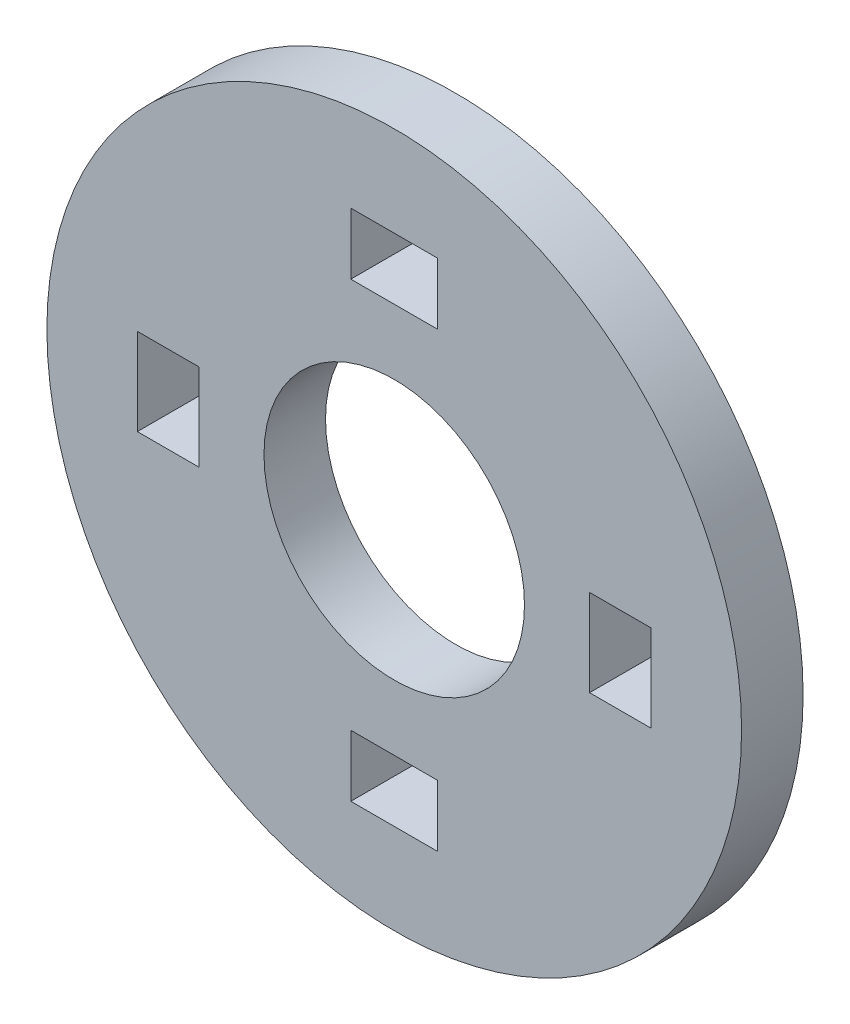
SolidWorks part; units mm, degrees
ref_plane "Front Plane" through (0, 0, 0) normal (0, 0, 1) x (1, 0, 0)
ref_plane "Top Plane" through (0, 0, 0) normal (0, 1, 0) x (1, 0, 0)
ref_plane "Right Plane" through (0, 0, 0) normal (1, 0, 0) x (0, 0, -1)
sketch "Sketch1" plane through (0, 0, 0) normal (0, 0, 1) x (1, 0, 0)
  circle A0 centre (0, 0) radius 2.5
  circle A1 centre (0, 0) radius 25.4
  dimension "D1" = 5
  dimension "D2" = 50.8
extrude "Boss-Extrude1" add sketch "Sketch1" along normal blind 4.5
sketch "Sketch2" plane through (0, 0, 4.5) normal (0, 0, 1) x (1, 0, 0)
  line L0 (0, 18.7836) -> (0, 14.2836) construction
  line L1 (-3.175, 18.7836) -> (3.175, 18.7836)
  line L2 (-3.175, 18.7836) -> (-3.175, 14.2836)
  line L3 (-3.175, 14.2836) -> (3.175, 14.2836)
  line L4 (3.175, 18.7836) -> (3.175, 14.2836)
  line L5 (14.2836, 3.175) -> (14.2836, -3.175)
  line L6 (18.7836, 3.175) -> (14.2836, 3.175)
  line L7 (18.7836, 3.175) -> (18.7836, -3.175)
  line L8 (18.7836, -3.175) -> (14.2836, -3.175)
  line L9 (3.175, -14.2836) -> (-3.175, -14.2836)
  line L10 (3.175, -18.7836) -> (3.175, -14.2836)
  line L11 (3.175, -18.7836) -> (-3.175, -18.7836)
  line L12 (-3.175, -18.7836) -> (-3.175, -14.2836)
  line L13 (-14.2836, -3.175) -> (-14.2836, 3.175)
  line L14 (-18.7836, -3.175) -> (-14.2836, -3.175)
  line L15 (-18.7836, -3.175) -> (-18.7836, 3.175)
  line L16 (-18.7836, 3.175) -> (-14.2836, 3.175)
  circle A0 centre (0, 0) radius 19.05
  circle A1 centre (0, 0) radius 17.4625
  point P26 (0, 0)
  dimension "D1" = 38.1
  dimension "D3" = 4.5
  dimension "D4" = 6.35
  dimension "D5" = 0
  dimension "D2" = 1.5875
  dimension "D6" = 4
extrude "Cut-Extrude1" cut sketch "Sketch2" against normal through all contours L16 A1 L14 L13 | A1 L16 L15 L14 | L1 L0 A1 L4 | L0 L1 L2 A1 | L0 A1 L2 L3 | A1 L0 L3 L4 | L8 A1 L6 L5 | A1 L8 L7 L6 | L12 A1 L10 L9 | A1 L12 L11 L10
sketch "Sketch3" plane through (0, 0, 4.5) normal (0, 0, 1) x (1, 0, 0)
  circle A0 centre (0, 0) radius 9.525
  point P8 (0, 0)
  dimension "D1" = 19.05
extrude "Cut-Extrude2" cut sketch "Sketch3" against normal blind 4.5
